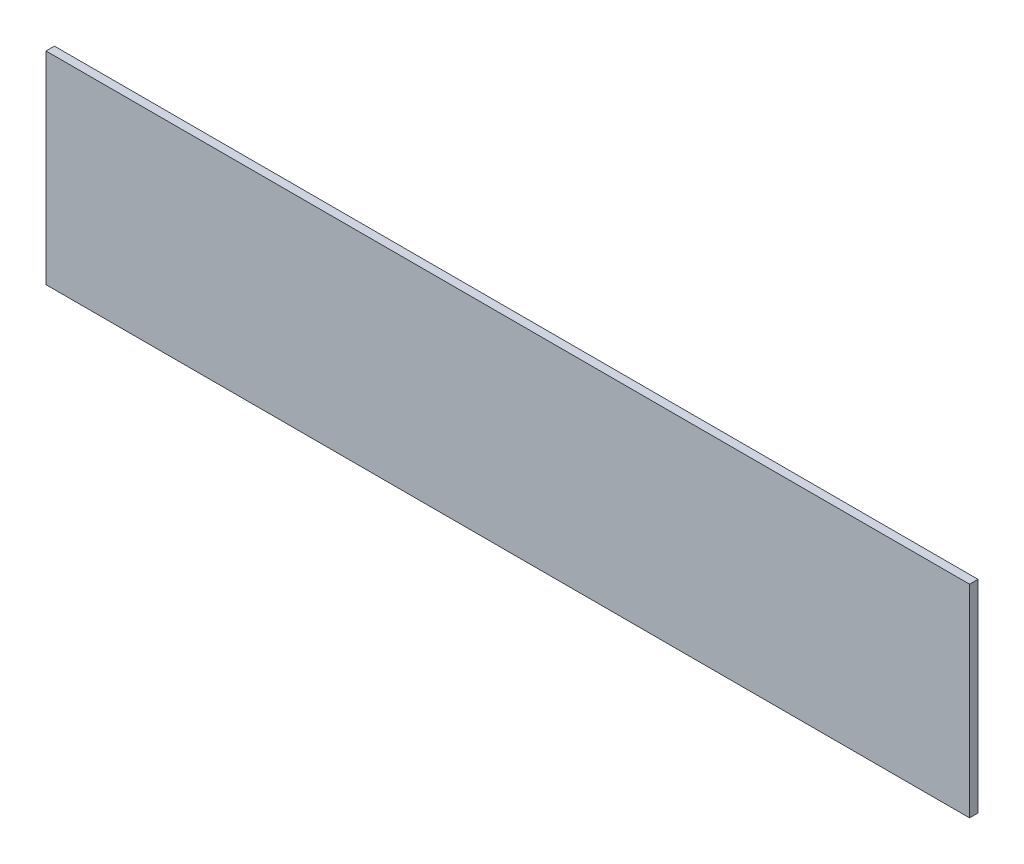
SolidWorks part; units mm, degrees
ref_plane "前视基准面" through (0, 0, 0) normal (0, 0, 1) x (1, 0, 0)
ref_plane "上视基准面" through (0, 0, 0) normal (0, 1, 0) x (1, 0, 0)
ref_plane "右视基准面" through (0, 0, 0) normal (1, 0, 0) x (0, 0, -1)
sketch "草图1" plane through (0, 0, 0) normal (0, 0, 1) x (1, 0, 0)
  line L1 (0, 0) -> (657, 0)
  line L2 (0, 0) -> (0, 144)
  line L3 (0, 144) -> (657, 144)
  line L4 (657, 0) -> (657, 144)
  dimension "D1" = 657
  dimension "D2" = 144
extrude "拉伸1" add sketch "草图1" along normal blind 6
